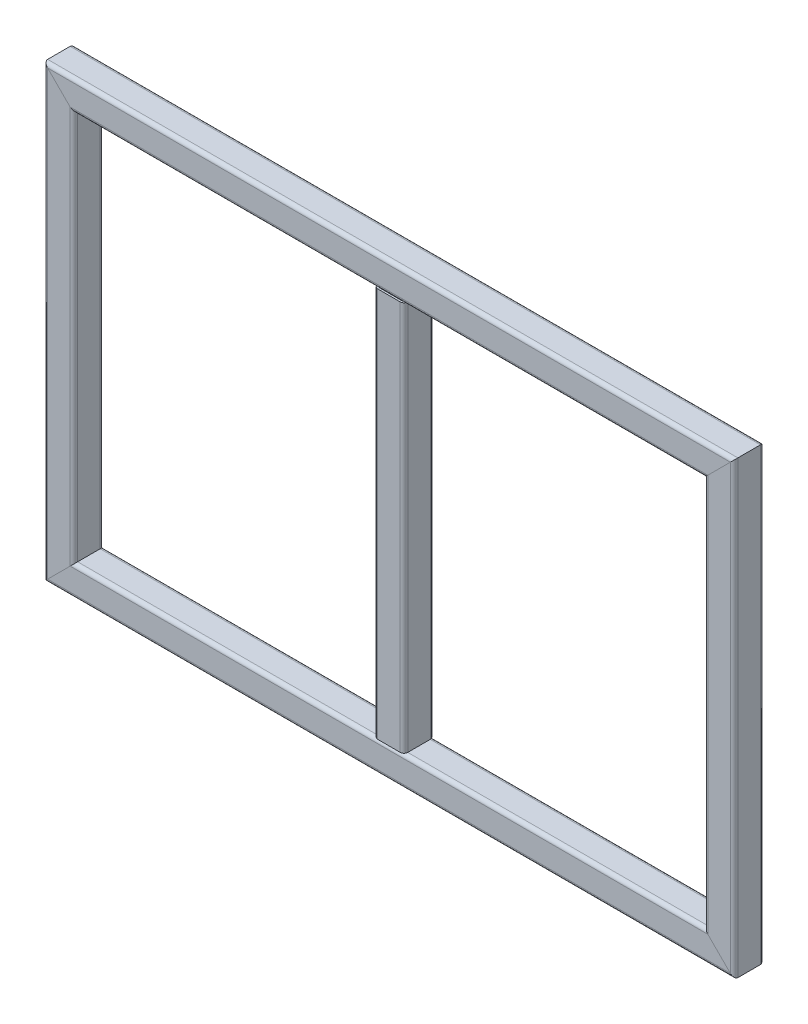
SolidWorks part; units mm, degrees
ref_plane "Płaszczyzna przednia" through (0, 0, 0) normal (0, 0, 1) x (1, 0, 0)
ref_plane "Płaszczyzna górna" through (0, 0, 0) normal (0, 1, 0) x (1, 0, 0)
ref_plane "Płaszczyzna prawa" through (0, 0, 0) normal (1, 0, 0) x (0, 0, -1)
sketch "Szkic1" plane through (0, 0, 0) normal (0, 0, 1) x (1, 0, 0)
  line L0 (-880, -1200) -> (880, -1200) construction
  line L1 (880, -1200) -> (880, -80) construction
  line L2 (-880, -80) -> (880, -80) construction
  line L3 (-880, -1200) -> (-880, -80) construction
  line L4 (-880, -1200) -> (880, -1200)
  line L5 (880, -1200) -> (880, -80)
  line L6 (-880, -80) -> (880, -80)
  line L7 (-880, -1200) -> (-880, -80)
  line L8 (0, -80) -> (0, -1200)
other "Człon konstrukcyjny1"
ref_plane "Płaszczyzna1" through (-880, -1200, 0) normal (0, 1, 0) x (-1, 0, 0)
sketch "Sketch1" plane through (-880, -1200, 0) normal (0, 1, 0) x (-1, 0, 0)
  line L0 (-30, -35) -> (30, -35)
  line L1 (-35, -30) -> (-35, 30)
  line L2 (30, 35) -> (-30, 35)
  line L3 (35, 30) -> (35, -30)
  line L4 (-30, -40) -> (30, -40)
  line L5 (-40, -30) -> (-40, 30)
  line L6 (30, 40) -> (-30, 40)
  line L7 (40, 30) -> (40, -30)
  arc A0 (40, 30) -> (30, 40) centre (30, 30) ccw
  arc A1 (30, -40) -> (40, -30) centre (30, -30) ccw
  arc A2 (-40, -30) -> (-30, -40) centre (-30, -30) ccw
  arc A3 (-30, 40) -> (-40, 30) centre (-30, 30) ccw
  arc A4 (-30, 35) -> (-35, 30) centre (-30, 30) ccw
  arc A5 (35, 30) -> (30, 35) centre (30, 30) ccw
  arc A6 (30, -35) -> (35, -30) centre (30, -30) ccw
  arc A7 (-35, -30) -> (-30, -35) centre (-30, -30) ccw
  point P0 (-40, 0)
  point P1 (40, 0)
  point P2 (0, 40)
  point P3 (0, -40)
  point P4 (0, 0)
  point P5 (-40, -40)
  point P6 (40, -40)
  point P7 (40, 40)
  point P8 (-40, 40)
  point P33 (0, 0)
  dimension "D1" = 10
  dimension "Thickness" = 5
  dimension "V_leg" = 80
